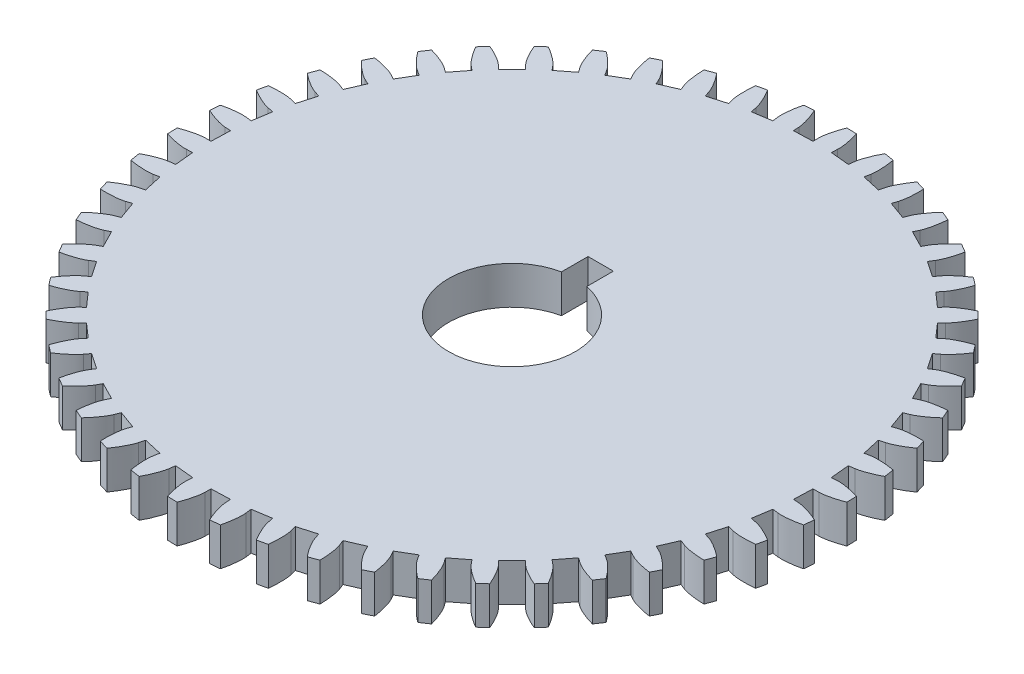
SolidWorks part; units mm, degrees
ref_plane "Front Plane" through (0, 0, 0) normal (0, 0, 1) x (1, 0, 0)
ref_plane "Top Plane" through (0, 0, 0) normal (0, 1, 0) x (1, 0, 0)
ref_plane "Right Plane" through (0, 0, 0) normal (1, 0, 0) x (0, 0, -1)
sketch "Sketch1" plane through (0, 0, 0) normal (0, 1, 0) x (1, 0, 0)
  line L0 (0, 0) -> (0, 12.1018) construction
  line L1 (0, 0) -> (-12.1018, 0) construction
  line L2 (0, 0) -> (-12.9936, -0.4083) construction
  line L3 (0, 0) -> (-12.078, -0.7599) construction
  line L4 (0, 0) -> (-12.0064, -1.5168) construction
  circle A0 centre (0, 0) radius 12.5 construction
  circle A1 centre (0, 0) radius 12.1018 construction
  circle A2 centre (0, 0) radius 11.875 construction
  circle A3 centre (0, 0) radius 13 construction
  spline S0 degree 4 poles (-12.1018, 0) (-12.123, 0) (-12.1825, -0.0022) (-12.2944, -0.0149) (-12.4752, -0.0478) (-12.7022, -0.1074) (-12.9902, -0.2042) (-13.3209, -0.3434) (-13.6737, -0.522) (-14.0442, -0.7428) (-14.4007, -0.9862) (-14.743, -1.2493) (-15.0712, -1.5296) (-15.4524, -1.8888) (-15.8861, -2.3482) (-16.356, -2.92) (-16.8432, -3.6138) (-17.2872, -4.3547) (-17.6802, -5.1234) (-17.9804, -5.8172) (-18.2073, -6.4229) (-18.3766, -6.936) (-18.5002, -7.3476) (-18.6404, -7.8721) (-18.7611, -8.3914) (-18.8636, -8.9309) (-18.9638, -9.5554) (-19.0305, -10.1179) (-19.077, -10.6083) (-19.1144, -11.2989) (-19.1236, -11.6543) (-19.1283, -12.2081) (-19.1183, -12.4606) (-19.114, -12.6843) (-19.1097, -12.7514) (-19.108, -12.7998) (-19.1071, -12.8259) knots 0 0 0 0 0 0.005377 0.015084 0.028532 0.04661 0.064855 0.092111 0.119476 0.146842 0.174209 0.201575 0.228941 0.256307 0.307035 0.361767 0.4165 0.471232 0.525964 0.580697 0.608063 0.635429 0.662795 0.690161 0.744894 0.77226 0.799626 0.854358 0.881725 0.909091 0.954545 0.977273 0.988636 0.994318 1 1 1 1 1 construction
  spline S1 degree 4 poles (-12.1018, 0) (-12.123, 0) (-12.1825, -0.0022) (-12.2944, -0.0149) (-12.4752, -0.0478) (-12.7022, -0.1074) (-12.9902, -0.2042) (-13.3209, -0.3434) (-13.6737, -0.522) (-14.0442, -0.7428) (-14.4007, -0.9862) (-14.743, -1.2493) (-15.0712, -1.5296) (-15.4524, -1.8888) (-15.8861, -2.3482) (-16.356, -2.92) (-16.8432, -3.6138) (-17.2872, -4.3547) (-17.6802, -5.1234) (-17.9804, -5.8172) (-18.2073, -6.4229) (-18.3766, -6.936) (-18.5002, -7.3476) (-18.6404, -7.8721) (-18.7611, -8.3914) (-18.8636, -8.9309) (-18.9638, -9.5554) (-19.0305, -10.1179) (-19.077, -10.6083) (-19.1034, -11.0963) (-19.1117, -11.2934) (-19.1149, -11.3914) knots 0 0 0 0 0 0.005377 0.015084 0.028532 0.04661 0.064855 0.092111 0.119476 0.146842 0.174209 0.201575 0.228941 0.256307 0.307035 0.361767 0.4165 0.471232 0.525964 0.580697 0.608063 0.635429 0.662795 0.690161 0.744894 0.77226 0.799626 0.854358 0.881725 0.909091 0.909091 0.909091 0.909091 0.909091
  dimension "D1" = 26
  dimension "D2" = 25
  dimension "D3" = 24.2037
  dimension "D4" = 23.75
  dimension "D5" = 12.1018
  dimension "D6" = 1.8
  dimension "D7" = 3.6
  dimension "D8" = 7.2
sketch "Sketch2" plane through (0, 0, 0) normal (0, 1, 0) x (1, 0, 0)
  line L0 (0, 0) -> (-12.9936, -0.4083) construction
  line L1 (0, 0) -> (-12.9936, -0.4083) construction
  line L2 (0, 0) -> (-12.078, -0.7599) construction
  line L3 (0, 0) -> (-12.1018, 0) construction
  line L4 (0, 0) -> (-12.0064, -1.5168) construction
  line L5 (0, 0) -> (-12.078, -0.7599) construction
  line L6 (0, 0) -> (-12.1018, 0) construction
  line L7 (0, 0) -> (-12.0064, -1.5168) construction
  line L8 (-12.078, -0.7599) -> (-11.8516, -0.7456)
  line L9 (-11.8516, -0.7456) -> (-11.7814, -1.4883)
  line L10 (-11.7814, -1.4883) -> (-12.0064, -1.5168) construction
  line L11 (-11.7814, -1.4883) -> (-2.4803, -0.3133)
  line L12 (-12.1018, 0) -> (-2.5, 0)
  circle A0 centre (0, 0) radius 11.875 construction
  circle A1 centre (0, 0) radius 12.1018 construction
  circle A2 centre (0, 0) radius 12.5 construction
  circle A3 centre (0, 0) radius 13 construction
  circle A4 centre (0, 0) radius 11.875 construction
  circle A5 centre (0, 0) radius 12.1018 construction
  circle A6 centre (0, 0) radius 12.5 construction
  circle A7 centre (0, 0) radius 13 construction
  arc A8 (-12.986, -0.6039) -> (-12.9983, -0.2127) centre (0, 0) cw
  circle A11 centre (0, 0) radius 2.5 construction
  arc A12 (-2.5, 0) -> (-2.4803, -0.3133) centre (0, 0) ccw
  spline S0 degree 4 poles (-72.4365, -1998.9619) (-8.5514, -39.6205) (-9.2103, -0.8348) (-10.9161, 0.2359) (-12.4752, -0.0478) (-12.7022, -0.1074) (-12.9902, -0.2042) (-13.3209, -0.3434) (-13.6737, -0.522) (-14.0442, -0.7428) (-14.4007, -0.9862) (-14.743, -1.2493) (-15.0712, -1.5296) (-15.4524, -1.8888) (-15.8861, -2.3482) (-16.356, -2.92) (-16.8432, -3.6138) (-17.2872, -4.3547) (-17.6802, -5.1234) (-17.9804, -5.8172) (-18.2073, -6.4229) (-18.3766, -6.936) (-18.5002, -7.3476) (-18.6404, -7.8721) (-18.7611, -8.3914) (-18.8636, -8.9309) (-18.9638, -9.5554) (-19.0305, -10.1179) (-19.2372, -12.2989) (-19.1319, -17.0789) (-16.744, 39.3584) (-84.0555, -2010.1845) knots -0.35521 -0.35521 -0.35521 -0.35521 -0.35521 0.005377 0.015084 0.028532 0.04661 0.064855 0.092111 0.119476 0.146842 0.174209 0.201575 0.228941 0.256307 0.307035 0.361767 0.4165 0.471232 0.525964 0.580697 0.608063 0.635429 0.662795 0.690161 0.744894 0.77226 0.799626 0.854358 0.881725 1.380796 1.380796 1.380796 1.380796 1.380796 only from (-12.1018, 0) to (-19.1149, -11.3914) construction
  spline S1 degree 4 poles (-12.1018, 0) (-12.123, 0) (-12.1825, -0.0022) (-12.2944, -0.0149) (-12.4752, -0.0478) (-12.6787, -0.1012) (-12.8422, -0.1547) (-12.9538, -0.1957) (-12.9983, -0.2127) knots 0 0 0 0 0 0.005377 0.015084 0.028532 0.04661 0.058695 0.058695 0.058695 0.058695 0.058695
  spline S2 degree 4 poles (-12.078, -0.7599) (-12.0991, -0.7612) (-12.1586, -0.7628) (-12.271, -0.7571) (-12.4536, -0.7356) (-12.6601, -0.6951) (-12.8266, -0.652) (-12.9405, -0.6181) (-12.986, -0.6039) knots 0 0 0 0 0 0.005377 0.015084 0.028532 0.04661 0.058695 0.058695 0.058695 0.058695 0.058695
  point P21 (-11.8516, -0.7456)
  point P24 (-11.7814, -1.4883)
  dimension "D2" = 5
extrude "Boss-Extrude1" add sketch "Sketch2" along normal blind 1.5
pattern_circular "CirPattern1" count 50 over 360 of "Boss-Extrude1"
sketch "Sketch3" plane through (0, 1.5, 0) normal (0, 1, 0) x (1, 0, 0)
  line L1 (0.5, 1.5) -> (-0.5, 1.5)
  line L2 (0.5, 1.5) -> (0.5, 3.5)
  line L3 (0.5, 3.5) -> (-0.5, 3.5)
  line L4 (-0.5, 1.5) -> (-0.5, 3.5)
  line L5 (0.5, 1.5) -> (-0.5, 3.5) construction
  line L6 (0.5, 3.5) -> (-0.5, 1.5) construction
  circle A0 centre (0, 0) radius 2.5 construction
  point P0 (0, 2.5)
  dimension "D1" = 2
  dimension "D2" = 1
extrude "Cut-Extrude1" cut sketch "Sketch3" against normal up to surface (1.5 mm away)
equation "\"Module\"= .5"
equation "\"Number of Teeth\"= 50"
equation "\"Pressure Angle\"= 14.5deg"
equation "\"Pitch Diameter\"= \"Number of Teeth\" * \"Module\""
equation "\"Circular Pitch\"= pi * \"Module\""
equation "\"Addendum\"= \"Module\""
equation "\"Dedendum\"= 1.25 * \"Module\""
equation "\"Base Diameter\"= \"Pitch Diameter\" * cos ( \"Pressure Angle\" )"
equation "\"Base Radius\"= \"Base Diameter\" / 2"
equation "\"Width\"= 1.5"
equation "\"Outside Diameter\"= \"Pitch Diameter\" + 2 * \"Addendum\""
equation "\"D1@Sketch1\"=\"Outside Diameter\""
equation "\"D3@Sketch1\"=\"Base Diameter\""
equation "\"Root Diameter\"= \"Pitch Diameter\" - 2 * \"Dedendum\""
equation "\"D4@Sketch1\"=\"Root Diameter\""
equation "\"Tooth Angle\"= 360 / \"Number of Teeth\""
equation "\"D6@Sketch1\"=\"Tooth Angle\"/4"
equation "\"D7@Sketch1\"=\"Tooth Angle\"/2"
equation "\"D8@Sketch1\"=\"Tooth Angle\""
equation "\"D2@Sketch1\" = \"Pitch Diameter\""
equation "\"Shaft Diameter\" = 5"
equation "\"D1@CirPattern1\" = \"Number of Teeth\""
equation "\"D2@Sketch2\"= \"Shaft Diameter\""
equation "\"D1@Boss-Extrude1\" = \"Width\""
